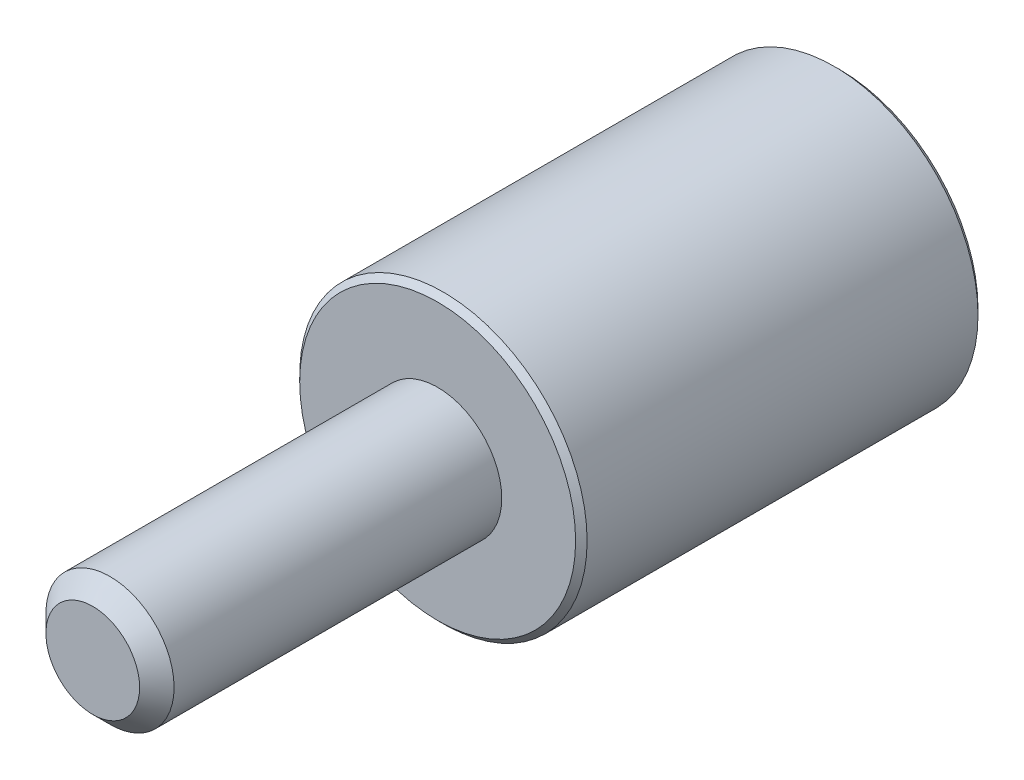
SolidWorks part; units mm, degrees
ref_plane "Top Plane" through (0, 0, 0) normal (0, 0, 1) x (1, 0, 0)
ref_plane "Front Plane" through (0, 0, 0) normal (0, 1, 0) x (1, 0, 0)
ref_plane "Right Plane" through (0, 0, 0) normal (1, 0, 0) x (0, 0, -1)
sketch "Sketch1" plane through (0, 0, 0) normal (0, 0, 1) x (1, 0, 0)
  circle A0 centre (0, 0) radius 6.45
  circle A1 centre (0, 0) radius 12.5
  dimension "D1" = 12.9
  dimension "D2" = 25
extrude "Boss-Extrude1" add sketch "Sketch1" along normal blind 30
sketch "Sketch2" plane through (0, 0, 30) normal (0, 0, 1) x (1, 0, 0)
  circle A0 centre (0, 0) radius 12.5
  dimension "D1" = 25
extrude "Boss-Extrude2" add sketch "Sketch2" along normal blind 5
sketch "Sketch3" plane through (0, 0, 35) normal (0, 0, 1) x (1, 0, 0)
  circle A0 centre (0, 0) radius 5.575
  dimension "D1" = 11.15
extrude "Boss-Extrude3" add sketch "Sketch3" along normal blind 30
chamfer "Chamfer1" distance 1.5 angle 45 1 edges at (5.575, 0, 65)
chamfer "Chamfer2" distance 0.5 angle 45 2 edges at (12.5, 0, 0) (12.5, 0, 35)
chamfer "Chamfer3" distance 1 angle 45 1 edges at (6.45, 0, 0)
